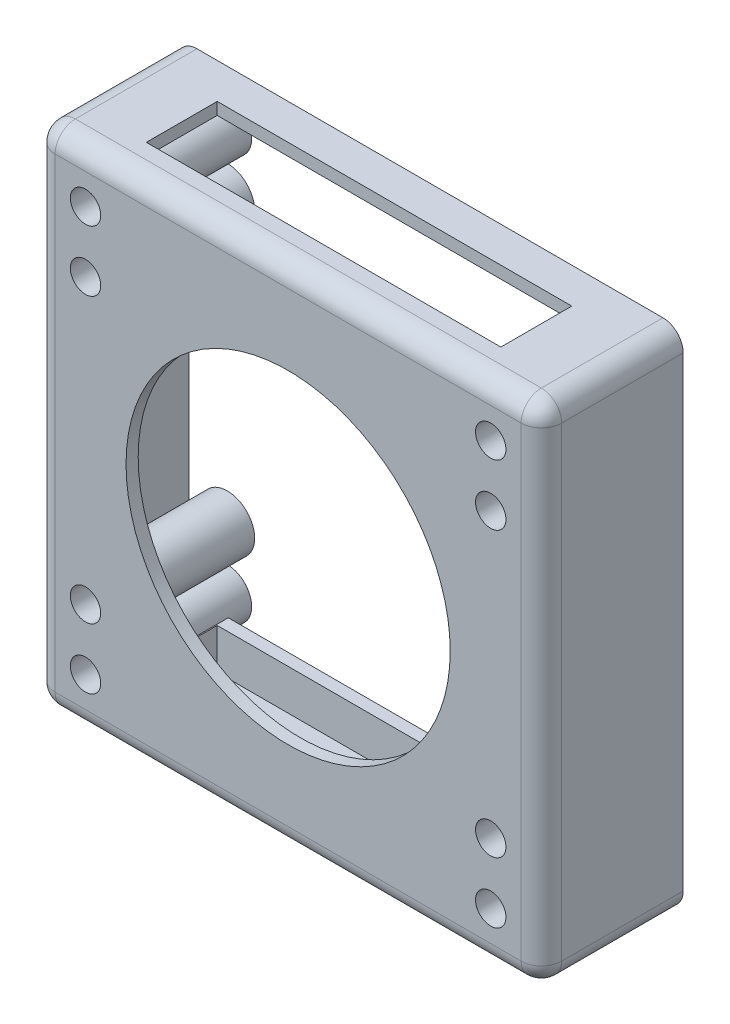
SolidWorks part; units mm, degrees
ref_plane "Alzado" through (0, 0, 0) normal (0, 0, 1) x (1, 0, 0)
ref_plane "Planta" through (0, 0, 0) normal (0, 1, 0) x (1, 0, 0)
ref_plane "Vista lateral" through (0, 0, 0) normal (1, 0, 0) x (0, 0, -1)
sketch "Croquis1" plane through (0, 0, 0) normal (0, 0, 1) x (1, 0, 0)
  line L1 (-62.5, -62.5) -> (62.5, -62.5)
  line L2 (-62.5, -62.5) -> (-62.5, 62.5)
  line L3 (-62.5, 62.5) -> (62.5, 62.5)
  line L4 (62.5, -62.5) -> (62.5, 62.5)
  line L5 (-62.5, -62.5) -> (62.5, 62.5) construction
  line L6 (-62.5, 62.5) -> (62.5, -62.5) construction
  point P0 (0, 0)
  dimension "D1" = 125
  dimension "D2" = 125
extrude "Saliente-Extruir1" add sketch "Croquis1" along normal blind 35
fillet "Redondeo1" radius 5 8 edges at (0, -62.5, 35) (-62.5, 0, 35) (0, 62.5, 35) (62.5, 0, 35) (-62.5, -62.5, 17.5) (62.5, -62.5, 17.5) (-62.5, 62.5, 17.5) (62.5, 62.5, 17.5)
shell "Vaciado1" thickness 3
sketch "Croquis2" plane through (0, 0, 35) normal (0, 0, 1) x (1, 0, 0)
  line L1 (-30, -40) -> (30, -40) construction
  line L2 (-40, -30) -> (-40, 30) construction
  line L3 (-30, 40) -> (30, 40) construction
  line L4 (40, -30) -> (40, 30) construction
  line L5 (-40, -40) -> (40, 40) construction
  line L6 (-40, 40) -> (40, -40) construction
  arc A0 (-40, 30) -> (-30, 40) centre (-30, 30) cw construction
  arc A1 (-30, -40) -> (-40, -30) centre (-30, -30) cw construction
  arc A2 (30, -40) -> (40, -30) centre (30, -30) ccw construction
  arc A3 (30, 40) -> (40, 30) centre (30, 30) cw construction
  circle A4 centre (0, 0) radius 40
  point P0 (0, 0)
  dimension "D3" = 10
  dimension "D4" = 80
  dimension "D1" = 80
  dimension "D2" = 80
extrude "Cortar-Extruir1" cut sketch "Croquis2" against normal up to next
sketch "Croquis3" plane through (0, 62.5, 0) normal (0, 1, 0) x (1, 0, 0)
  line L1 (-43.75, -26.25) -> (43.75, -26.25)
  line L2 (-43.75, -26.25) -> (-43.75, -8.75)
  line L3 (-43.75, -8.75) -> (43.75, -8.75)
  line L4 (43.75, -26.25) -> (43.75, -8.75)
  line L5 (0, 0) -> (0, -35) construction
  line L6 (57.5, -35) -> (-57.5, -35) construction
  line L7 (-43.75, -26.25) -> (43.75, -8.75) construction
  line L8 (-43.75, -8.75) -> (43.75, -26.25) construction
  point P0 (0, -17.5)
  dimension "D1" = 17.5
  dimension "D2" = 87.5
extrude "Cortar-Extruir2" cut sketch "Croquis3" against normal up to next
sketch "Croquis4" plane through (0, 0, 0) normal (0, 0, 1) x (1, 0, 0)
  circle A0 centre (50, 35) radius 6.75
  circle A1 centre (50, 35) radius 3.75
  circle A2 centre (50, 35) radius 1.875
  circle A3 centre (-50, 35) radius 6.75
  circle A4 centre (-50, 35) radius 3.75
  circle A5 centre (-50, 35) radius 1.875
  circle A6 centre (-50, -35) radius 3.75
  circle A7 centre (-50, -35) radius 1.875
  circle A8 centre (-50, -35) radius 6.75
  circle A9 centre (50, -35) radius 3.75
  circle A10 centre (50, -35) radius 1.875
  circle A11 centre (50, -35) radius 6.75
  dimension "D1" = 3.75
  dimension "D2" = 7.5
  dimension "D3" = 3
  dimension "D4" = 35
  dimension "D5" = 50
  dimension "D6" = 100
  dimension "D7" = 70
sketch "Croquis10" plane through (0, 0, 0) normal (0, 0, 1) x (1, 0, 0)
  circle A0 centre (50, 35) radius 6.75 construction
  circle A1 centre (50, -35) radius 6.75 construction
  circle A2 centre (-50, -35) radius 6.75 construction
  circle A3 centre (-50, 35) radius 6.75 construction
  circle A4 centre (50, 35) radius 6.75
  circle A5 centre (50, -35) radius 6.75
  circle A6 centre (-50, -35) radius 6.75
  circle A7 centre (-50, 35) radius 6.75
extrude "Saliente-Extruir4" add sketch "Croquis10" along normal up to next
sketch "Croquis11" plane through (0, 0, 0) normal (0, 0, 1) x (1, 0, 0)
  circle A0 centre (-50, -35) radius 1.875 construction
  circle A1 centre (50, -35) radius 1.875 construction
  circle A2 centre (-50, 35) radius 1.875 construction
  circle A3 centre (50, 35) radius 1.875 construction
  circle A4 centre (-50, -35) radius 1.875
  circle A5 centre (50, -35) radius 1.875
  circle A6 centre (-50, 35) radius 1.875
  circle A7 centre (50, 35) radius 1.875
extrude "Cortar-Extruir8" cut sketch "Croquis11" along normal up to next
ref_plane "Plano1" through (0, 0, 5) normal (0, 0, 1) x (1, 0, 0)
sketch "Croquis12" plane through (0, 0, 5) normal (0, 0, 1) x (1, 0, 0)
  circle A0 centre (50, -35) radius 3.75 construction
  circle A1 centre (-50, -35) radius 3.75 construction
  circle A2 centre (-50, 35) radius 3.75 construction
  circle A3 centre (50, 35) radius 3.75 construction
  circle A4 centre (50, -35) radius 3.75
  circle A5 centre (-50, -35) radius 3.75
  circle A6 centre (-50, 35) radius 3.75
  circle A7 centre (50, 35) radius 3.75
extrude "Cortar-Extruir9" cut sketch "Croquis12" along normal up to next
sketch "Croquis8" plane through (0, 0, 0) normal (0, 0, 1) x (1, 0, 0)
  circle A0 centre (50, 50) radius 6
  circle A1 centre (-50, 50) radius 6
  circle A2 centre (-50, -50) radius 6
  circle A3 centre (50, -50) radius 6
  dimension "D1" = 100
  dimension "D2" = 100
  dimension "D3" = 50
  dimension "D4" = 50
  dimension "D5" = 12
extrude "Saliente-Extruir3" add sketch "Croquis8" along normal up to next
sketch "Croquis9" plane through (0, 0, 0) normal (0, 0, 1) x (1, 0, 0)
  circle A0 centre (50, 50) radius 3.75
  circle A1 centre (-50, 50) radius 3.75
  circle A2 centre (-50, -50) radius 3.75
  circle A3 centre (50, -50) radius 3.75
  dimension "D1" = 7.5
extrude "Cortar-Extruir7" cut sketch "Croquis9" along normal up to next
ref_plane "Plano2" through (0, -49.5, 0) normal (0, -1, 0) x (-1, 0, 0)
sketch "Croquis13" plane through (0, -49.5, 0) normal (0, 1, 0) x (1, 0, 0)
  line L0 (57.5, -35) -> (-57.5, -35) construction
  line L1 (-46.75, -5.75) -> (46.75, -5.75)
  line L2 (-46.75, -5.75) -> (-46.75, -35)
  line L3 (-46.75, -35) -> (46.75, -35)
  line L4 (-43.75, -26.25) -> (43.75, -26.25)
  line L5 (43.75, -26.25) -> (43.75, -8.75)
  line L6 (43.75, -8.75) -> (-43.75, -8.75)
  line L7 (-43.75, -8.75) -> (-43.75, -26.25)
  line L8 (-43.75, -26.25) -> (43.75, -26.25)
  line L9 (43.75, -26.25) -> (43.75, -8.75)
  line L10 (43.75, -8.75) -> (-43.75, -8.75)
  line L11 (-43.75, -8.75) -> (-43.75, -26.25)
  line L12 (46.75, -5.75) -> (46.75, -35)
  dimension "D2" = 3
  dimension "D3" = 3
  dimension "D4" = 3
  dimension "D1" = 0
extrude "Saliente-Extruir5" add sketch "Croquis13" against normal up to next
sketch "Croquis14" plane through (0, 0, 35) normal (0, 0, 1) x (1, 0, 0)
  circle A0 centre (-50, -50) radius 3.75
  arc A1 (-46.2835, -49.5) -> (-46.75, -51.8708) centre (-50, -50) ccw construction
  circle A2 centre (50, -50) radius 3.75
  arc A3 (46.75, -51.8708) -> (46.2835, -49.5) centre (50, -50) ccw construction
extrude "Cortar-Extruir10" cut sketch "Croquis14" against normal through all and the other way through all
